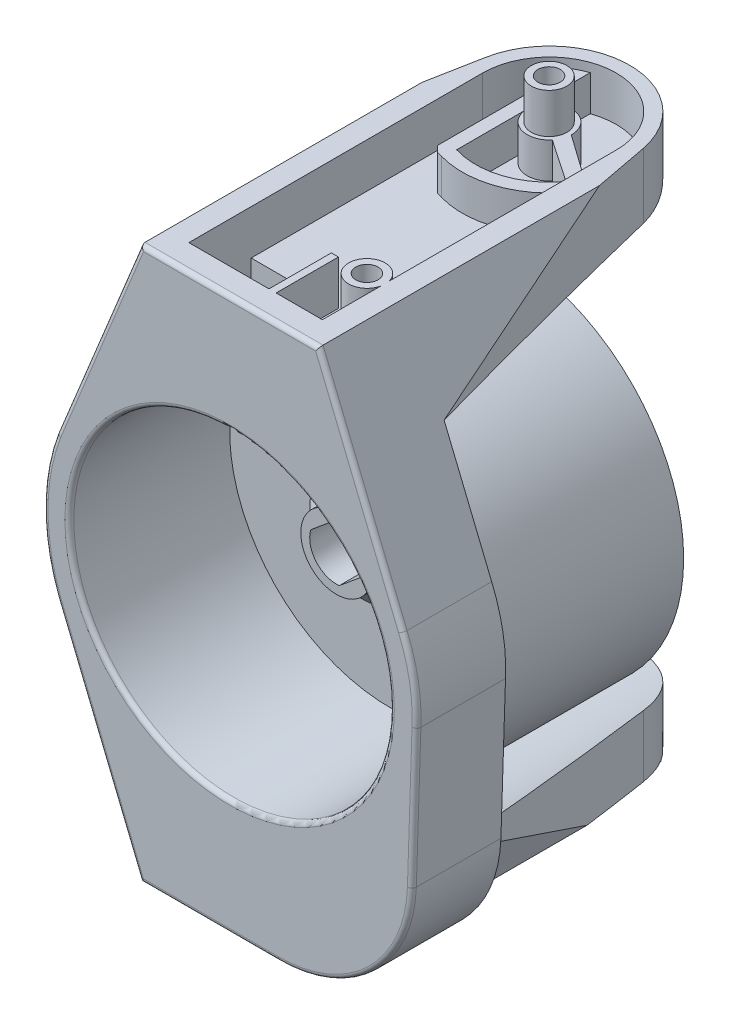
SolidWorks part; units mm, degrees
ref_plane "Plan1" through (0, 0, 0) normal (0, 0, 1) x (1, 0, 0)
ref_plane "Plan2" through (0, 0, 0) normal (0, 1, 0) x (1, 0, 0)
ref_plane "Plan3" through (0, 0, 0) normal (1, 0, 0) x (0, 0, -1)
sketch "Esquisse1" plane through (0, 0, 0) normal (0, 0, 1) x (1, 0, 0)
  line L0 (-10, 31) -> (10, 31) construction
  line L1 (-10, -31) -> (20, -31) construction
  line L2 (10, 31) -> (-10, 31)
  line L3 (-10, 31) -> (-19.4343, 7.9567)
  line L4 (-19.4343, -7.9567) -> (-10, -31)
  line L5 (-10, -31) -> (20, -31)
  line L6 (20, -31) -> (20.9888, -0.6846)
  line L7 (10, 31) -> (19.4343, 7.9567)
  circle A0 centre (0, 0) radius 21 construction
  arc A1 (-19.4343, 7.9567) -> (-19.4343, -7.9567) centre (1.5049, 0) ccw
  arc A2 (20.9888, -0.6846) -> (19.4343, 7.9567) centre (1.1151, 0.2006) ccw
  dimension "D1" = 42
  dimension "D2" = 31
  dimension "D3" = 31
  dimension "D4" = 20
  dimension "D5" = 30
  dimension "D6" = 10
  dimension "D7" = 10
extrude "Base-Extrusion" add sketch "Esquisse1" along normal blind 10
fillet "Congé1" radius 15 1 edges at (20, -31, 5)
sketch "Esquisse2" plane through (0, 0, 0) normal (0, 0, -1) x (-1, 0, 0)
  line L0 (-10, 31) -> (10, 31)
  line L1 (10, 31) -> (14.0941, 21)
  line L2 (10, 31) -> (19.4343, 7.9567) construction
  line L3 (-10, 31) -> (-14.0941, 21)
  line L4 (-19.4343, 7.9567) -> (-10, 31) construction
  line L5 (-14.0941, 21) -> (14.0941, 21)
  line L6 (0, 0) -> (10, 0) construction
  line L7 (10, -31) -> (-10, -31)
  line L8 (10, -31) -> (14.0941, -21)
  line L9 (19.4343, -7.9567) -> (10, -31) construction
  line L10 (14.0941, -21) -> (-14.0941, -21)
  line L11 (10, -31) -> (-5.4813, -31) construction
  line L12 (-10, -31) -> (-14.0941, -21)
  dimension "D1" = 10
  dimension "D2" = 10
extrude "Boss.-Extru.1" add sketch "Esquisse2" along normal blind 35
sketch "Esquisse3" plane through (0, 31, 0) normal (0, 1, 0) x (-1, 0, 0)
  line L1 (14.0941, 0) -> (8.863, -27.6096)
  line L2 (-14.0941, 0) -> (-8.8464, -27.6145)
  line L3 (14.0941, 0) -> (20, -20)
  line L4 (-14.0941, 0) -> (-20, -20)
  line L5 (-20, -20) -> (-20, -40)
  line L6 (-20, -40) -> (20, -40)
  line L7 (20, -40) -> (20, -20)
  arc A1 (-8.8464, -27.6145) -> (8.863, -27.6096) centre (0.0079, -25.9319) ccw
extrude "Enlèv. mat.-Extru.1" cut sketch "Esquisse3" against normal through all
sketch "Esquisse4" plane through (0, 0, 0) normal (0, 0, -1) x (-1, 0, 0)
  circle A0 centre (0, 0) radius 25.2912
extrude "Enlèv. mat.-Extru.2" cut sketch "Esquisse4" along normal blind 40
sketch "Esquisse6" plane through (0, 0, 0) normal (0, 0, -1) x (-1, 0, 0)
  circle A0 centre (0, 0) radius 20
  dimension "D1" = 40
extrude "Boss.-Extru.2" add sketch "Esquisse6" along normal blind 21
sketch "Esquisse7" plane through (0, 0, -21) normal (0, 0, -1) x (-1, 0, 0)
  circle A0 centre (0, 0) radius 19
  dimension "D1" = 38
extrude "Enlèv. mat.-Extru.3" cut sketch "Esquisse7" against normal blind 10
sketch "Esquisse8" plane through (0, 0, 10) normal (0, 0, 1) x (1, 0, 0)
  circle A0 centre (0, 0) radius 18
  dimension "D1" = 36
extrude "Enlèv. mat.-Extru.4" cut sketch "Esquisse8" against normal blind 18
sketch "Esquisse9" plane through (0, 0, -11) normal (0, 0, -1) x (-1, 0, 0)
  line L0 (-2.8725, -0.8652) -> (-0.32, -2.9829)
  line L1 (0.32, 2.9829) -> (2.8725, 0.8652)
  circle A0 centre (0, 0) radius 3 construction
  arc A1 (0.32, 2.9829) -> (-2.8725, -0.8652) centre (0.033, -0.0274) ccw
  arc A2 (2.8725, 0.8652) -> (-0.32, -2.9829) centre (0.0103, -0.0086) cw
  dimension "D1" = 6
  dimension "D2" = 5
sketch "Esquisse10" plane through (0, 0, -8) normal (0, 0, 1) x (1, 0, 0)
  circle A0 centre (0, 0) radius 6
  dimension "D1" = 12
extrude "Boss.-Extru.3" add sketch "Esquisse10" along normal blind 5
sketch "Esquisse11" plane through (0, 0, -3) normal (0, 0, 1) x (1, 0, 0)
  circle A0 centre (0, 0) radius 4
  dimension "D1" = 8
extrude "Boss.-Extru.4" add sketch "Esquisse11" along normal blind 1
chamfer "Chanfrein3" distance 2 angle 45 1 edges at (6, 0, -3)
extrude "Enlèv. mat.-Extru.6" cut sketch "Esquisse9" against normal through all
sketch "Esquisse12" plane through (0, 31, 0) normal (0, 1, 0) x (-1, 0, 0)
  line L0 (7.5079, -25.9319) -> (7.5079, 7.0681)
  line L1 (-7.4921, -25.9319) -> (-7.4921, 7.0681)
  line L2 (7.5079, 7.0681) -> (-7.4921, 7.0681)
  circle A0 centre (0.0079, -25.9319) radius 7.5 construction
  arc A1 (-7.4921, -25.9319) -> (7.5079, -25.9319) centre (0.0079, -25.9319) ccw
  dimension "D1" = 15
  dimension "D2" = 33
extrude "Enlèv. mat.-Extru.7" cut sketch "Esquisse12" against normal blind 5
sketch "Esquisse13" plane through (0, -31, 0) normal (0, -1, 0) x (1, 0, 0)
  line L0 (-7.5079, -25.9319) -> (-7.5079, 7.0681)
  line L1 (-7.5079, 7.0681) -> (7.4921, 7.0681)
  line L2 (7.4921, 7.0681) -> (7.4921, -25.9319)
  circle A0 centre (-0.0079, -25.9319) radius 7.5 construction
  arc A1 (-7.5079, -25.9319) -> (7.4921, -25.9319) centre (-0.0079, -25.9319) ccw
  dimension "D1" = 15
  dimension "D2" = 33
extrude "Enlèv. mat.-Extru.8" cut sketch "Esquisse13" against normal blind 5
sketch "Esquisse14" plane through (0, 0, 0) normal (0, 0, 1) x (1, 0, 0)
  line L0 (7.4921, -30.8646) -> (7.4921, -31)
  line L1 (7.4921, -31) -> (10, -31)
  line L2 (10, -31) -> (10.3296, -30.1948)
  arc A0 (7.4921, -30.8646) -> (10.3296, -30.1948) centre (5.7696, -17.2214) ccw
  arc A1 (5.4813, -31) -> (20.4733, -16.489) centre (5.4813, -16) ccw construction
extrude "Enlèv. mat.-Extru.9" cut sketch "Esquisse14" against normal through all
fillet "Congé10" radius 0.5 10 edges at (-14.7171, -19.4783, 10) (18, 0, 10) (-2.2594, -31, 10) (20.6942, 3.7229, 10) (14.7171, 19.4783, 10) (20.7311, -8.5868, 10) (15.9136, -26.7781, 10) (0, 31, 10) (-14.7171, 19.4783, 10) (-20.8951, 0, 10)
sketch "Esquisse15" plane through (0, -26, 0) normal (0, -1, 0) x (1, 0, 0)
  line L0 (-7.5079, 7.0681) -> (-7.5079, -25.9319) construction
  line L1 (7.4921, 7.0681) -> (-7.5079, 7.0681)
  line L2 (7.4921, 7.0681) -> (7.4921, 3.0681)
  line L3 (7.4921, 3.0681) -> (-7.5079, 3.0681)
  line L4 (-7.5079, 7.0681) -> (-7.5079, 3.0681)
  dimension "D1" = 4
extrude "Enlèv. mat.-Extru.10" cut sketch "Esquisse15" against normal blind 5
sketch "Esquisse16" plane through (0, -26, 0) normal (0, -1, 0) x (1, 0, 0)
  line L0 (7.4921, -19.9319) -> (4.4921, -19.9319)
  line L1 (7.4921, -25.9319) -> (7.4921, 0) construction
  line L2 (4.4921, -19.9319) -> (4.4921, -21.9319)
  line L3 (4.4921, -21.9319) -> (1.1134, -23.6974)
  line L4 (2.3929, -25.2346) -> (7.4921, -23.9319)
  line L5 (7.4921, -23.9319) -> (7.4921, -19.9319)
  circle A0 centre (-0.0079, -25.9319) radius 2.5 construction
  arc A1 (1.1134, -23.6974) -> (2.3929, -25.2346) centre (-0.0299, -25.9503) ccw
  dimension "D1" = 5
  dimension "D2" = 3
  dimension "D3" = 2
  dimension "D4" = 6
  dimension "D5" = 4
  dimension "D6" = 2
extrude "Boss.-Extru.5" add sketch "Esquisse16" along normal blind 4
sketch "Esquisse17" plane through (0, -30, 0) normal (0, -1, 0) x (1, 0, 0)
  circle A0 centre (-0.0079, -25.9319) radius 2
  circle A1 centre (-0.0079, -25.9319) radius 1.25
  dimension "D1" = 4
  dimension "D2" = 2.5
extrude "Boss.-Extru.6" add sketch "Esquisse17" along normal blind 4.5
sketch "Esquisse18" plane through (0, -26, 0) normal (0, -1, 0) x (1, 0, 0)
  line L0 (7.4921, 3.0681) -> (-6.5079, 3.0681)
  line L2 (7.4921, 3.0681) -> (7.4921, -1.9319)
  line L3 (7.4921, -19.9319) -> (7.4921, 3.0681) construction
  line L4 (7.4921, -1.9319) -> (4.4921, -1.9319)
  line L5 (4.4921, -1.9319) -> (4.4921, 0.3009)
  line L6 (4.4921, 0.3009) -> (0.4921, 0.3009)
  line L7 (-7.5079, 3.0681) -> (7.4921, 3.0681) construction
  line L8 (-6.5079, 3.0681) -> (-6.5079, 0)
  line L9 (-3.7878, -1.9319) -> (0.4921, -1.9319)
  line L10 (0.4921, -1.9319) -> (0.4921, 0.3009)
  arc A0 (-6.5079, 0) -> (-3.7878, -1.9319) centre (-4.0696, 0.5522) ccw
  dimension "D1" = 2.5
  dimension "D2" = 14
  dimension "D3" = 5
  dimension "D4" = 3
  dimension "D5" = 4
extrude "Boss.-Extru.7" add sketch "Esquisse18" along normal blind 4
sketch "Esquisse19" plane through (0, -30, 0) normal (0, -1, 0) x (1, 0, 0)
  line L0 (-1.5696, 3.0681) -> (-6.5079, 3.0681)
  line L1 (7.4921, 3.0681) -> (-6.5079, 3.0681) construction
  line L2 (-1.5696, 3.0681) -> (-1.5696, 0.5522)
  line L4 (-6.5079, 3.0681) -> (-6.5079, 0)
  arc A0 (-6.5079, 0) -> (-1.5696, 0.5522) centre (-4.0696, 0.5522) ccw
extrude "Boss.-Extru.8" add sketch "Esquisse19" along normal blind 1
sketch "Esquisse20" plane through (0, -31, 0) normal (0, -1, 0) x (1, 0, 0)
  circle A0 centre (-4.0696, 0.5522) radius 1.25
  dimension "D1" = 2.5
extrude "Enlèv. mat.-Extru.11" cut sketch "Esquisse20" against normal blind 4
sketch "Esquisse21" plane through (0, 26, 0) normal (0, 1, 0) x (-1, 0, 0)
  circle A0 centre (0.0079, -25.9319) radius 2.5
  dimension "D1" = 5
extrude "Boss.-Extru.9" add sketch "Esquisse21" along normal blind 4
sketch "Esquisse22" plane through (0, 26, 0) normal (0, 1, 0) x (-1, 0, 0)
  line L0 (2.4979, -33.0065) -> (2.4979, -18.0065)
  line L1 (3.9979, -32.2825) -> (3.9979, -20.3096)
  line L2 (3.9979, -20.3096) -> (3.9979, -16.8667)
  line L3 (-7.4921, 7.0681) -> (-7.4921, -25.9319) construction
  line L5 (-7.4921, -22.3447) -> (-2.4352, -25.9252)
  line L6 (3.9979, -16.8667) -> (2.7262, -16.524)
  line L7 (-6.72, -21.0587) -> (-1.5049, -24.6112)
  line L8 (-1.5049, 9.5) -> (-1.5049, 0) construction
  line L10 (-2.4352, -25.9252) -> (-1.5049, -24.6112)
  line L11 (-7.4921, -22.3447) -> (-7.9145, -22.3447)
  line L12 (-7.9145, -22.3447) -> (-7.9145, -19.6352)
  line L13 (-7.9145, -19.6352) -> (-7.4921, -19.6352)
  arc A0 (-7.4921, -25.9319) -> (7.5079, -25.9319) centre (0.0079, -25.9319) ccw construction
  arc A1 (2.7262, -16.524) -> (-7.4921, -19.6352) centre (0.0079, -25.9319) ccw
  arc A2 (2.4979, -18.0065) -> (-6.72, -21.0587) centre (0.0079, -25.9319) ccw
  arc A5 (2.4979, -33.0065) -> (3.9979, -32.2825) centre (0.0079, -25.9319) ccw
  dimension "D1" = 1.5
  dimension "D5" = 9.7928
  dimension "D2" = 15
  dimension "D3" = 1.5
  dimension "D4" = 1.5
  dimension "D6" = 2.49
extrude "Boss.-Extru.12" add sketch "Esquisse22" along normal blind 4
sketch "Esquisse23" plane through (0, 30, 0) normal (0, 1, 0) x (-1, 0, 0)
  circle A0 centre (0, -25.8852) radius 2
  circle A1 centre (0, -25.8852) radius 1.25
  dimension "D1" = 4
  dimension "D2" = 2.5
extrude "Boss.-Extru.13" add sketch "Esquisse23" along normal blind 4.5
chamfer "Chanfrein5" distance 0.5 angle 45 1 edges at (-3.9979, 28, -16.8667)
sketch "Esquisse24" plane through (0, 26, 0) normal (0, 1, 0) x (-1, 0, 0)
  line L1 (7.5079, 7.0681) -> (0.5079, 7.0681)
  line L2 (7.5079, 7.0681) -> (7.5079, 0.0681)
  line L3 (7.5079, 0.0681) -> (0.5079, 0.0681)
  line L4 (0.5079, 7.0681) -> (0.5079, 0.0681)
  dimension "D1" = 7
  dimension "D2" = 7
extrude "Enlèv. mat.-Extru.12" cut sketch "Esquisse24" against normal blind 17
sketch "Esquisse25" plane through (0, 26, 0) normal (0, 1, 0) x (-1, 0, 0)
  line L0 (-7.4921, 7.0681) -> (-7.4921, -25.9319) construction
  line L1 (7.5079, 7.0681) -> (-7.4921, 7.0681) construction
  line L2 (0.5079, 7.0681) -> (-7.4921, 7.0681) construction
  line L3 (-2.2921, 7.0681) -> (-1.4921, 7.0681)
  line L4 (-2.2921, 7.0681) -> (-2.2921, 0.0681)
  line L5 (-2.2921, 0.0681) -> (-1.4921, 0.0681)
  line L6 (-1.4921, 7.0681) -> (-1.4921, 0.0681)
  line L7 (0.5079, 7.0681) -> (0.5079, 0.0681) construction
  circle A0 centre (-5.4921, 0.0681) radius 2.05
  circle A1 centre (-5.4921, 0.0681) radius 1.25
  dimension "D2" = 4.1
  dimension "D4" = 2.5
  dimension "D1" = 2
  dimension "D3" = 7
  dimension "D5" = 7
  dimension "D6" = 2
  dimension "D7" = 0.8
extrude "Boss.-Extru.14" add sketch "Esquisse25" along normal blind 5
sketch "Esquisse26" plane through (0, 0, -11) normal (0, 0, -1) x (-1, 0, 0)
  line L0 (-12.0208, 12.0208) -> (-9.9826, 9.8156)
  line L1 (-3.8652, 13.4559) -> (-2.4986, 9.6828)
  line L2 (16.0758, -5.529) -> (9.4592, -3.2441)
  arc A0 (-12.0208, 12.0208) -> (16.0758, -5.529) centre (0, 0) cw
  arc A1 (9.4592, -3.2441) -> (-2.4986, 9.6828) centre (0, 0) ccw
  arc A2 (-3.8652, 13.4559) -> (-9.9826, 9.8156) centre (0, 0) ccw
  dimension "D1" = 17
  dimension "D2" = 10
  dimension "D3" = 14
extrude "Boss.-Extru.15" add sketch "Esquisse26" along normal blind 3
sketch "Esquisse27" plane through (0, 0, -14) normal (0, 0, -1) x (-1, 0, 0)
  line L0 (0, 17) -> (0, 10)
  line L1 (8.7583, 4.8262) -> (14.9602, 8.0741)
  arc A0 (0, 10) -> (8.7583, 4.8262) centre (0, 0) cw
  arc A2 (0, 17) -> (14.9602, 8.0741) centre (0, 0) cw
  arc A3 (16.0758, -5.529) -> (-12.0208, 12.0208) centre (0, 0) ccw construction
  arc A4 (9.4592, -3.2441) -> (-2.4986, 9.6828) centre (0, 0) ccw construction
extrude "Boss.-Extru.16" add sketch "Esquisse27" along normal blind 3
sketch "Esquisse28" plane through (0, -26, 0) normal (0, -1, 0) x (1, 0, 0)
  line L0 (3.7638, -5.8599) -> (1.1151, -15.5028)
  line L4 (0.8709, -5.0653) -> (-1.7778, -14.7082)
  line L5 (1.1151, 9.5) -> (1.1151, 0) construction
  arc A0 (0.8709, -5.0653) -> (3.7638, -5.8599) centre (2.3174, -5.4626) cw
  arc A1 (1.1151, -15.5028) -> (-1.7778, -14.7082) centre (-0.3313, -15.1055) cw
  dimension "D1" = 3
  dimension "D2" = 10
extrude "Enlèv. mat.-Extru.13" cut sketch "Esquisse28" against normal blind 0.5
